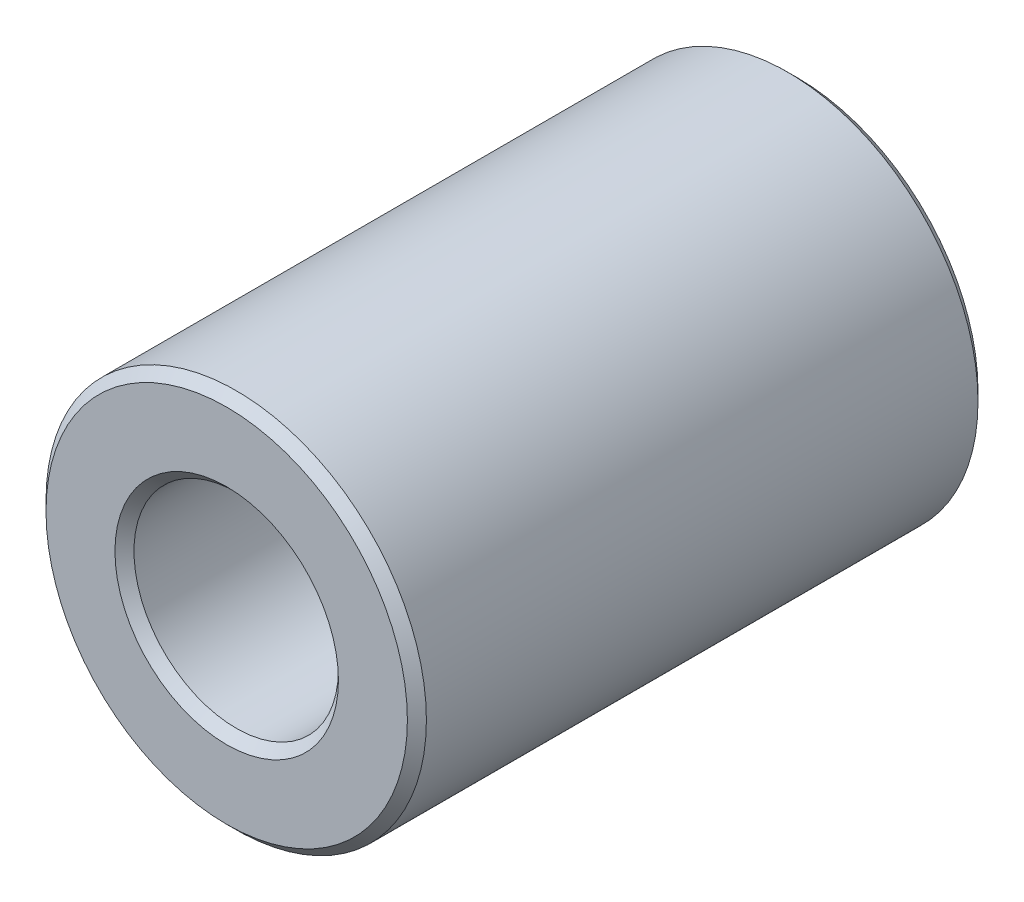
SolidWorks part; units mm, degrees
ref_plane "Front Plane" through (0, 0, 0) normal (0, 0, 1) x (1, 0, 0)
ref_plane "Top Plane" through (0, 0, 0) normal (0, 1, 0) x (1, 0, 0)
ref_plane "Right Plane" through (0, 0, 0) normal (1, 0, 0) x (0, 0, -1)
sketch "Sketch1" plane through (0, 0, 0) normal (0, 0, 1) x (1, 0, 0)
  circle A0 centre (0, 0) radius 4
  circle A1 centre (0, 0) radius 2.15
  dimension "D1" = 8
  dimension "D2" = 4.3
extrude "Boss-Extrude2" add sketch "Sketch1" along normal mid plane 12
chamfer "Chamfer3" distance 0.2 angle 45 4 edges at (4, 0, 6) (4, 0, -6) (2.15, 0, -6) (2.15, 0, 6)
